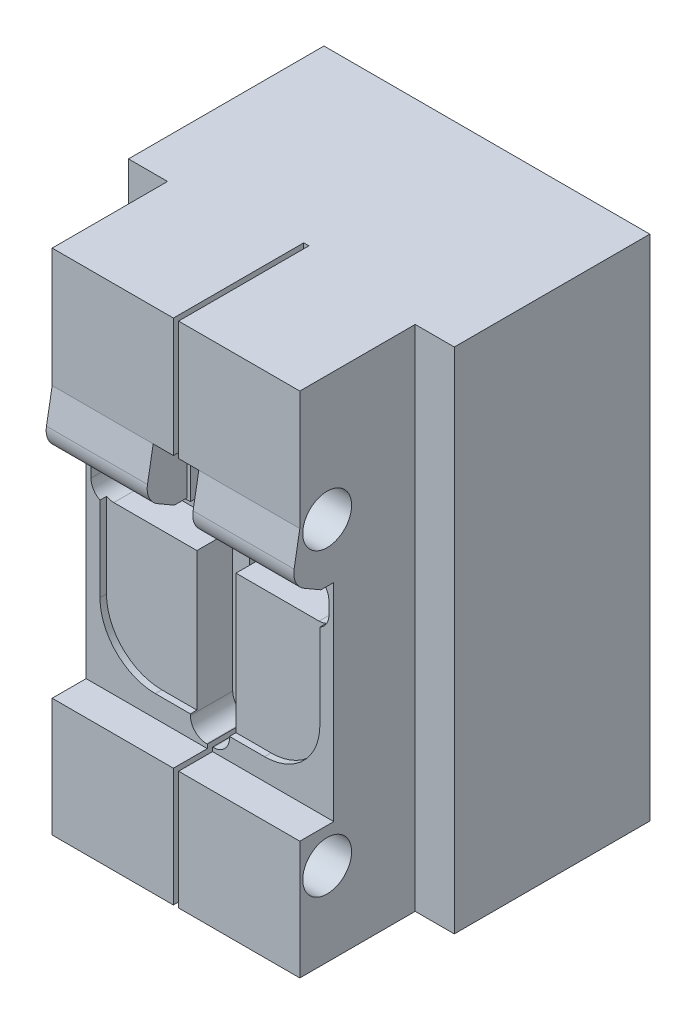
SolidWorks part; units mm, degrees
ref_plane "Ebene vorne" through (0, 0, 0) normal (0, 0, 1) x (1, 0, 0)
ref_plane "Ebene oben" through (0, 0, 0) normal (0, 1, 0) x (1, 0, 0)
ref_plane "Ebene rechts" through (0, 0, 0) normal (1, 0, 0) x (0, 0, -1)
sketch "Skizze1" plane through (0, 0, 0) normal (0, 0, 1) x (1, 0, 0)
  line L1 (-50, 78) -> (50, 78)
  line L2 (-50, 78) -> (-50, -78)
  line L3 (-50, -78) -> (50, -78)
  line L4 (50, 78) -> (50, -78)
extrude "Aufsatz-Linear austragen1" add sketch "Skizze1" against normal blind 85
sketch "Skizze2" plane through (0, 0, 0) normal (0, 0, 1) x (1, 0, 0)
  line L0 (33.75, 14.405) -> (33.75, -18) construction
  line L1 (16.75, -35) -> (-16.75, -35) construction
  line L2 (-33.75, -18) -> (-33.75, 14.405) construction
  line L3 (33.75, 14.405) -> (33.75, -18)
  line L4 (16.75, -35) -> (-16.75, -35)
  line L5 (-33.75, -18) -> (-33.75, 14.405)
  line L6 (-33.75, 14.405) -> (33.75, 14.405)
  arc A0 (16.75, -35) -> (33.75, -18) centre (16.75, -18) ccw construction
  arc A1 (-33.75, -18) -> (-16.75, -35) centre (-16.75, -18) ccw construction
  arc A2 (16.75, -35) -> (33.75, -18) centre (16.75, -18) ccw
  arc A3 (-33.75, -18) -> (-16.75, -35) centre (-16.75, -18) ccw
extrude "Schnitt-Linear austragen1" cut sketch "Skizze2" against normal blind 2
sketch "Skizze3" plane through (0, 0, 0) normal (0, 0, 1) x (1, 0, 0)
  line L0 (0, 85.6958) -> (0, -105.554) construction
  line L1 (-40.8678, 15.4) -> (39.7268, 15.4) construction
  line L2 (-4.8, 9.4) -> (-37.4167, 9.4) construction
  line L3 (-6, 15.4) -> (-6, -35.4314)
  line L4 (-1, 39.5686) -> (1, 39.5686)
  line L5 (-6, 34.5686) -> (-6, 21.4)
  line L6 (-1, -40.4314) -> (1, -40.4314)
  line L7 (6, 34.5686) -> (6, 21.4)
  line L8 (-31.5, 21.4) -> (-6, 21.4)
  line L9 (-36.5, 16.4) -> (-36.5, 12.4)
  line L10 (-31.5, 7.4) -> (-6, 7.4)
  line L11 (36.5, 16.4) -> (36.5, 12.4)
  line L12 (6, 21.4) -> (31.5, 21.4)
  line L13 (6, 7.4) -> (31.5, 7.4)
  line L14 (6, 7.4) -> (6, -35.4314)
  arc A0 (-6, -35.4314) -> (-1, -40.4314) centre (-1, -35.4314) ccw
  arc A1 (1, -40.4314) -> (6, -35.4314) centre (1, -35.4314) ccw
  arc A2 (-36.5, 12.4) -> (-31.5, 7.4) centre (-31.5, 12.4) ccw
  arc A3 (-31.5, 21.4) -> (-36.5, 16.4) centre (-31.5, 16.4) ccw
  arc A4 (31.5, 7.4) -> (36.5, 12.4) centre (31.5, 12.4) ccw
  arc A5 (31.5, 21.4) -> (36.5, 16.4) centre (31.5, 16.4) cw
  arc A6 (1, 39.5686) -> (6, 34.5686) centre (1, 34.5686) cw
  arc A7 (-1, 39.5686) -> (-6, 34.5686) centre (-1, 34.5686) ccw
  point P22 (6, -40.4314)
  point P25 (-36.5, 7.4)
  point P28 (-36.5, 21.4)
  point P33 (36.5, 21.4)
  point P36 (6, 39.5686)
  dimension "D5" = 5
  dimension "D7" = 5
  dimension "D8" = 5
  dimension "D9" = 5
  dimension "D10" = 5
  dimension "D12" = 5
  dimension "D1" = 12
  dimension "D2" = 8
  dimension "D3" = 73
  dimension "D4" = 80
  dimension "D6" = 6
  dimension "D11" = 2
extrude "Schnitt-Linear austragen4" cut sketch "Skizze3" against normal blind 13
sketch "Skizze4" plane through (0, 0, 0) normal (0, 0, 1) x (1, 0, 0)
  line L0 (-50, -78) -> (50, -78) construction
  line L1 (-50, 78) -> (-38, 78)
  line L2 (-50, 78) -> (-50, -78)
  line L3 (-50, -78) -> (-38, -78)
  line L4 (-38, 78) -> (-38, -78)
  line L6 (50, 78) -> (38, 78)
  line L7 (50, 78) -> (50, -78)
  line L8 (50, -78) -> (38, -78)
  line L9 (38, 78) -> (38, -78)
  dimension "D1" = 12
  dimension "D2" = 12
extrude "Schnitt-Linear austragen5" cut sketch "Skizze4" against normal blind 25
sketch "Skizze7" plane through (38, 0, 0) normal (1, 0, 0) x (0, 0, -1)
  line L0 (-10.4138, 41.4589) -> (-12.1622, 31.5432)
  line L1 (-9.0595, 24.8893) -> (-3.9223, 21.9234)
  line L2 (-3.9223, 21.9234) -> (0, 21.9234)
  line L3 (0, 78) -> (0, -78) construction
  line L4 (0, 21.9234) -> (0, 41.4589)
  line L5 (0, 41.4589) -> (-10.4138, 41.4589)
  arc A0 (-12.1622, 31.5432) -> (-9.0595, 24.8893) centre (-5.8595, 30.4319) ccw
extrude "Aufsatz-Linear austragen3" add sketch "Skizze7" against normal blind 31
mirror "Spiegeln1" about plane through (0, 0, 0) normal (1, 0, 0) of "Aufsatz-Linear austragen3"
sketch "Skizze8" plane through (38, 0, 0) normal (1, 0, 0) x (0, 0, -1)
  line L0 (-10.4138, 41.4589) -> (-10.4138, 78)
  line L1 (-10.4138, 41.4589) -> (0, 41.4589)
  line L2 (0, 41.4589) -> (0, 78)
  line L3 (0, 78) -> (-10.4138, 78)
extrude "Aufsatz-Linear austragen4" add sketch "Skizze8" against normal up to surface (76 mm away)
sketch "Skizze9" plane through (38, 0, 0) normal (1, 0, 0) x (0, 0, -1)
  line L0 (0, -41.6395) -> (-10.4138, -41.6395)
  line L1 (0, 21.9234) -> (0, -78) construction
  line L2 (-10.4138, -41.6395) -> (-10.4138, -78)
  line L3 (-10.4138, -78) -> (0, -78)
  line L4 (0, -78) -> (0, -41.6395)
  line L5 (-10.4138, 78) -> (-10.4138, -91.185) construction
extrude "Aufsatz-Linear austragen5" add sketch "Skizze9" against normal up to surface (76 mm away)
sketch "Skizze10" plane through (0, 0, 10.4138) normal (0, 0, 1) x (1, 0, 0)
  line L0 (0, 84.093) -> (0, -108.0096) construction
  line L2 (-0.8, 88.6958) -> (0.8, 88.6958)
  line L3 (-0.8, 88.6958) -> (-0.8, -99.0837)
  line L4 (-0.8, -99.0837) -> (0.8, -99.0837)
  line L5 (0.8, 88.6958) -> (0.8, -99.0837)
  dimension "D1" = 1.6
extrude "Schnitt-Linear austragen9" cut sketch "Skizze10" against normal blind 40
hole_wizard "Stirnsenkung fur M8 Zylinderschraube mit Innensechskant1" positions "3D-Skizze1" profile "Skizze11" counterbore size "M8" standard "Din"
sketch3d "3D-Skizze1"
  line L0 (38, -52.3528, 2.0201) -> (38, 66.6093, 2.0201) construction
  point P0 (38, -52.3528, 2.0201)
  point P2 (38, 39.6949, 2.0201)
sketch "Skizze11" plane through (38, -52.3528, 2.0201) normal (0, 1, 0) x (0, 0, -1)
  line L0 (0, 0) -> (0, 39.9029)
  line L1 (0, 39.9029) -> (4.5, 37.199)
  line L2 (4.5, 37.199) -> (4.5, 28.6)
  line L3 (4.5, 28.6) -> (7.5, 28.6)
  line L4 (7.5, 28.6) -> (7.5, 0)
  line L5 (7.5, 0) -> (0, 0)
  line L10 (0, 39.9029) -> (-4.5, 37.199) construction
  line L11 (0, -6.35) -> (0, 107.95) construction
  dimension "Bohrerdurchmesser" = 9
  dimension "Bohrungstiefe" = 37.199
  dimension "Senkdurchmesser2" = 15
  dimension "Senktiefe2" = 28.6
  dimension "Spitzenwinkel" = 118
